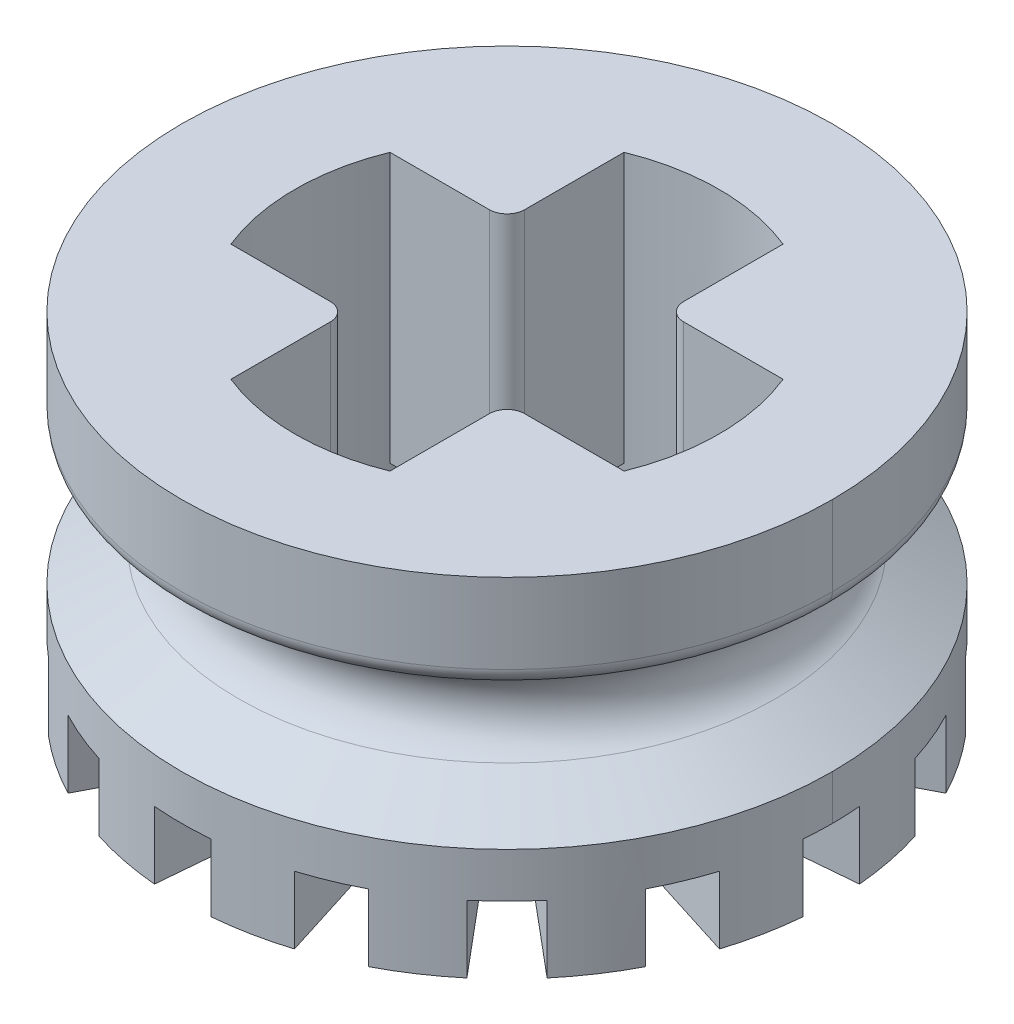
SolidWorks part; units mm, degrees
ref_plane "Front" through (0, 0, 0) normal (0, 0, 1) x (1, 0, 0)
ref_plane "Top" through (0, 0, 0) normal (0, 1, 0) x (1, 0, 0)
ref_plane "Right" through (0, 0, 0) normal (1, 0, 0) x (0, 0, -1)
sketch "Sketch1" plane through (0, 0, 0) normal (0, 1, 0) x (1, 0, 0)
  circle A0 centre (0, 0) radius 3.683
  dimension "D1" = 7.366
extrude "Base-Extrude" add sketch "Sketch1" along normal blind 3.937
sketch "Sketch2" plane through (0, 3.937, 0) normal (0, 1, 0) x (-1, 0, 0)
  circle A0 centre (0, 0) radius 2.3876
  dimension "D1" = 4.7752
extrude "Cut-Extrude1" cut sketch "Sketch2" against normal through all
sketch "Sketch4" plane through (0, 0, 0) normal (0, 0, 1) x (1, 0, 0)
  line L0 (-0.8167, 2.0955) -> (6.9225, 2.0955) construction
  line L1 (3.683, 2.921) -> (3.0384, 2.5298)
  line L2 (3.683, 0) -> (3.683, 3.937) construction
  line L3 (-3.683, 3.937) -> (3.683, 3.937) construction
  line L4 (3.683, 1.27) -> (3.0384, 1.6612)
  line L5 (0, 0) -> (0, 4.7179) construction
  line L6 (3.683, 2.921) -> (3.683, 1.27)
  arc A0 (3.0384, 2.5298) -> (3.0384, 1.6612) centre (3.302, 2.0955) ccw
  dimension "D4" = 0.508
  dimension "D1" = 1.016
  dimension "D2" = 1.651
  dimension "D3" = 5.588
revolve "Cut-Revolve1" cut sketch "Sketch4" angle 360 about L5
sketch "Sketch5" plane through (16.4943, 0, 2.5829) normal (0, -1, 0) x (1, 0, 0)
  line L0 (-16.4943, -2.5829) -> (-23.5814, -2.5829) construction
  line L1 (-16.4943, -2.5829) -> (-27.4899, -1.6209) construction
  line L2 (-18.8728, -2.3748) -> (-20.1633, -2.2619)
  line L3 (-18.8728, -2.791) -> (-20.1633, -2.9039)
  circle A0 centre (-16.4943, -2.5829) radius 2.3876 construction
  arc A1 (-18.8728, -2.3748) -> (-18.8728, -2.791) centre (-16.4943, -2.5829) ccw
  arc A2 (-20.1773, -2.5829) -> (-12.8113, -2.5829) centre (-16.4943, -2.5829) ccw construction
  arc A3 (-20.1633, -2.2619) -> (-20.1633, -2.9039) centre (-16.4943, -2.5829) ccw
  dimension "D1" = 10
extrude "Cut-Extrude2" cut sketch "Sketch5" against normal blind 0.762
pattern_circular "CirPattern1" count 16 every 22.5 about axis through (0, 0, 0) along (0, 1, 0) of "Cut-Extrude2"
sketch "Sketch6" plane through (0, 3.937, 0) normal (0, 1, 0) x (-1, 0, 0)
  line L0 (0, 0) -> (-4.1536, 0) construction
  line L1 (0, 0) -> (0, -5.1565) construction
  line L2 (-0.9208, -2.2029) -> (-0.9207, -0.9208)
  line L3 (-0.9207, -0.9208) -> (-2.2029, -0.9208)
  line L4 (0, 0) -> (-3.0791, 3.0791) construction
  line L5 (2.2029, 0.9207) -> (0.9208, 0.9207)
  line L6 (0.9208, 0.9207) -> (0.9208, 2.2029)
  circle A0 centre (0, 0) radius 2.3876 construction
  arc A1 (-2.2029, -0.9208) -> (-0.9208, -2.2029) centre (0, 0) ccw
  arc A2 (2.2029, 0.9207) -> (0.9208, 2.2029) centre (0, 0) ccw
  dimension "D1" = 0.9207
  dimension "D2" = 45
extrude "Boss-Extrude1" add sketch "Sketch6" against normal up to surface (3.175 mm away)
fillet "Fillet1" radius 0.3969 2 edges at (-0.9208, 2.3495, 0.9207) (0.9207, 2.3495, -0.9208)
fillet "Fillet2" radius 0.1984 2 edges at (0, 2.921, 3.683) (0, 2.921, -3.683)
sketch "Sketch7" plane through (0, 3.937, 0) normal (0, 1, 0) x (1, 0, 0)
  line L0 (-2.9601, 0) -> (3.8996, 0) construction
  line L1 (0, 3.9378) -> (0, -3.4372) construction
  circle A0 centre (0, 0) radius 2.4
  dimension "D1" = 4.8
extrude "Cut-Extrude3" cut sketch "Sketch7" along direction (0, -1, 0) on the side against the normal up to next (3.937 mm away)
sketch "Sketch8" plane through (0, 3.937, 0) normal (0, 1, 0) x (1, 0, 0)
  line L0 (-2.9325, 0) -> (3.3542, 0) construction
  line L1 (0, 2.9208) -> (0, -2.8853) construction
  line L2 (-2.2249, 0.9) -> (-0.9, 0.9)
  line L3 (-2.2249, -0.9) -> (-0.9, -0.9)
  line L4 (-0.9, 2.2249) -> (-0.9, 0.9)
  line L5 (0.9, 2.2249) -> (0.9, 0.9)
  line L6 (0.9, 0.9) -> (2.2249, 0.9)
  line L7 (0.9, -0.9) -> (0.9, -2.2249)
  line L8 (0.9, -0.9) -> (2.2249, -0.9)
  line L9 (-0.9, -0.9) -> (-0.9, -2.2249)
  arc A0 (-0.9, 2.2249) -> (-2.2249, 0.9) centre (0, 0) ccw
  arc A1 (2.2249, 0.9) -> (0.9, 2.2249) centre (0, 0) ccw
  arc A2 (0.9, -2.2249) -> (2.2249, -0.9) centre (0, 0) ccw
  arc A3 (-2.2249, -0.9) -> (-0.9, -2.2249) centre (0, 0) ccw
  dimension "D5" = 4.8
  dimension "D1" = 1.8
  dimension "D2" = 0.9
  dimension "D3" = 1.8
  dimension "D4" = 0.9
extrude "Boss-Extrude3" add sketch "Sketch8" against normal blind 3.048
fillet "Fillet3" radius 0.2 4 edges at (-0.9, 2.413, -0.9) (-0.9, 2.413, 0.9) (0.9, 2.413, -0.9) (0.9, 2.413, 0.9)
